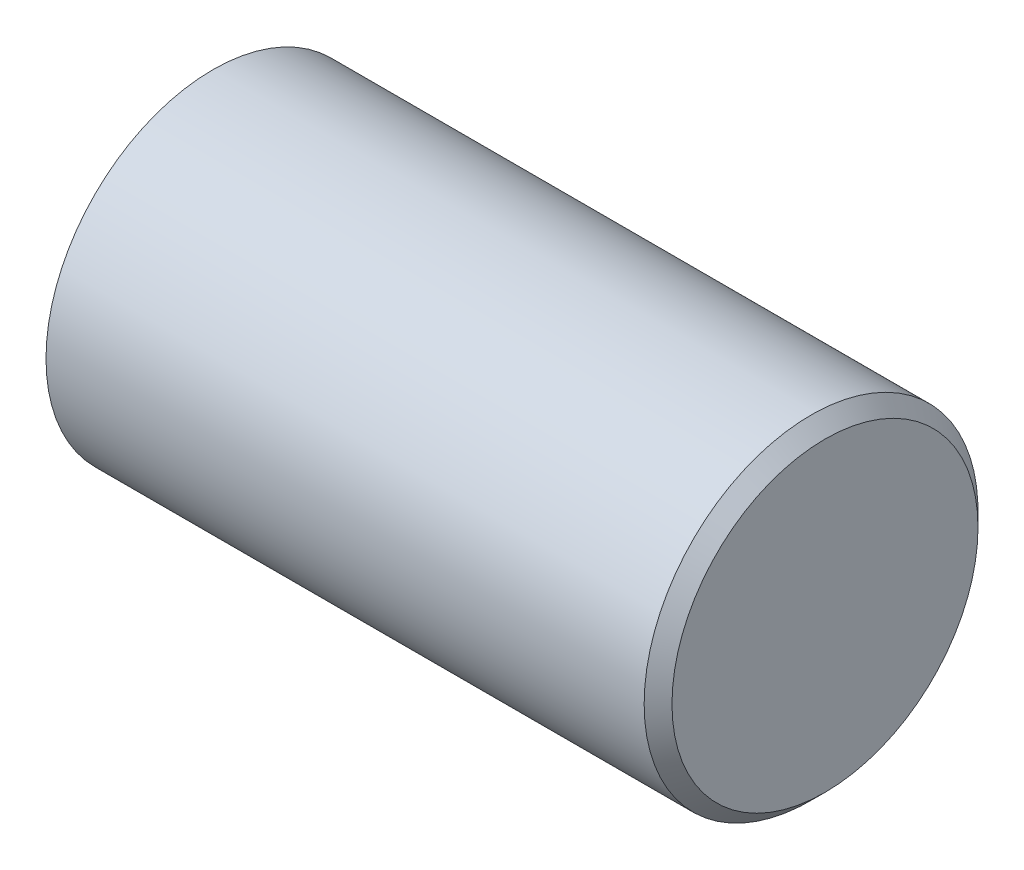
SolidWorks part; units mm, degrees
ref_plane "Plan de face" through (0, 0, 0) normal (0, 0, 1) x (1, 0, 0)
ref_plane "Plan de dessus" through (0, 0, 0) normal (0, 1, 0) x (1, 0, 0)
ref_plane "Plan de droite" through (0, 0, 0) normal (1, 0, 0) x (0, 0, -1)
sketch "Esquisse1" plane through (0, 0, 0) normal (0, 0, 1) x (1, 0, 0)
  line L0 (0, 0) -> (79.2693, 0) construction
  line L2 (0, 0) -> (24, 0)
  line L4 (2, 6) -> (24, 6)
  line L5 (24, 0) -> (24, 6)
  arc A0 (2, 6) -> (0, 0) centre (10, 0) ccw
  dimension "D3" = 10
  dimension "D1" = 12
  dimension "D2" = 24
  dimension "D4" = 2
revolve "Révolution1" add sketch "Esquisse1" angle 360 about L0
chamfer "Chanfrein1" distance 0.5 angle 45 1 edges at (24, 0, 6)
